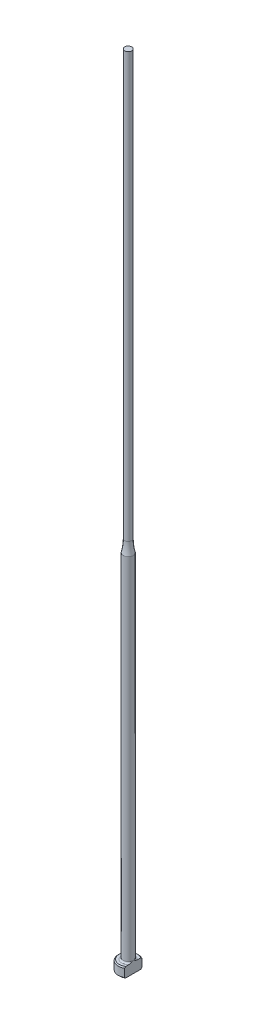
SolidWorks part; units mm, degrees
ref_plane "Front Plane" through (0, 0, 0) normal (0, 0, 1) x (1, 0, 0)
ref_plane "Top Plane" through (0, 0, 0) normal (0, 1, 0) x (1, 0, 0)
ref_plane "Right Plane" through (0, 0, 0) normal (1, 0, 0) x (0, 0, -1)
sketch "Sketch1" plane through (0, 0, 0) normal (0, 0, 1) x (1, 0, 0)
  line L0 (0, 259.9588) -> (0, -15.1925) construction
  line L1 (0, 0) -> (-2, 0)
  line L2 (-2, 0) -> (-2, 2)
  line L3 (-2, 2) -> (-1, 2)
  line L4 (-0.7, 75) -> (-0.7, 160)
  line L5 (-0.7, 160) -> (0, 160)
  line L6 (0, 160) -> (0, 0)
  line L7 (-1, 2) -> (-1, 72.569)
  arc A0 (-1, 72.569) -> (-0.7, 75) centre (-10.7, 75) ccw
  point P13 (-1, 0)
  dimension "D1" = 10
  dimension "L" = 160
  dimension "H" = 4
  dimension "T" = 2
  dimension "D" = 1.4
  dimension "B" = 2
  dimension "S" = 75
revolve "Revolve1" add sketch "Sketch1" angle 360 about L0
chamfer "Chamfer1" distance 0.2 angle 45 2 edges at (0, 2, 2) (0, 0, 2)
fillet "Fillet1" radius 0.3 1 edges at (0, 2, 1)
sketch "Sketch2" plane through (0, 0, 0) normal (0, 1, 0) x (1, 0, 0)
  line L0 (1, 1.7321) -> (1, -1.7321)
  circle A0 centre (0, 0) radius 2 construction
  arc A1 (1, -1.7321) -> (1, 1.7321) centre (0, 0) ccw
  circle A2 centre (0, 0) radius 1 construction
extrude "KEY" cut sketch "Sketch2" along normal through all
